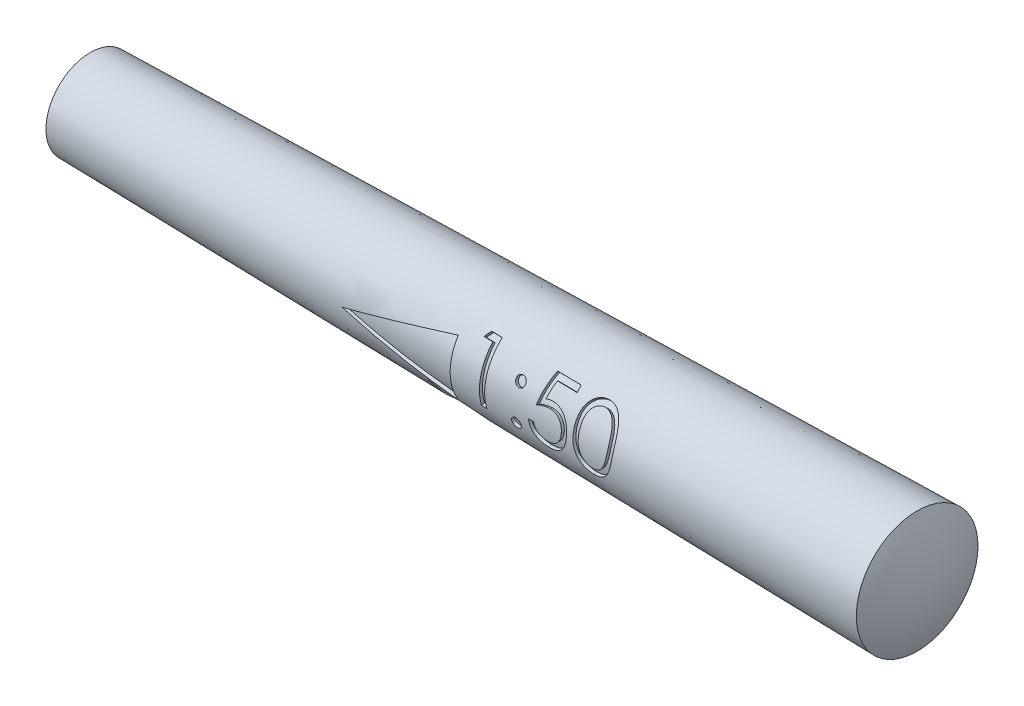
SolidWorks part; units mm, degrees
ref_plane "Front Plane" through (0, 0, 0) normal (0, 0, 1) x (1, 0, 0)
ref_plane "Top Plane" through (0, 0, 0) normal (0, 1, 0) x (1, 0, 0)
ref_plane "Right Plane" through (0, 0, 0) normal (1, 0, 0) x (0, 0, -1)
sketch "Sketch1" plane through (0, 0, 0) normal (1, 0, 0) x (0, 0, -1)
  circle A0 centre (0, 0) radius 0.75
  dimension "D1" = 1.5
extrude "Extrude1" add sketch "Sketch1" along normal mid plane 14
draft "Draft1" type of draft neutral plane draft angle 1.146 faces to draft 1 parameters "D1"=1.146
sketch "Sketch2" plane through (0, 0, 0) normal (0, 0, 1) x (1, 0, 0)
  line L0 (-7, 0) -> (-7, 0.75)
  line L1 (-7, 0.75) -> (-7, -0.75) construction
  line L2 (-7, 0) -> (-7.23, 0)
  line L3 (-7.23, 0) -> (-7.23, -0.89) construction
  line L4 (7, 0) -> (7, 1.03)
  line L5 (7, -1.03) -> (7, 1.03) construction
  line L6 (7, 0) -> (7.23, 0)
  line L7 (7.23, 0) -> (7.23, -0.89) construction
  line L8 (-7, -0.75) -> (7, -1.03) construction
  arc A0 (-7.23, 0) -> (-7, 0.75) centre (-5.8922, 0) cw
  arc A1 (7.23, 0) -> (7, 1.03) centre (4.8087, 0) ccw
  point P14 (0, -0.89)
revolve "Revolve1" add sketch "Sketch2" angle 360 about L2
sketch "Sketch5" plane through (0, 0, 0) normal (0, 0, 1) x (1, 0, 0)
  line L0 (0, 0.89) -> (0, -0.89) construction
  line L1 (7, 1.03) -> (-7, 0.75) construction
  line L2 (-7, -0.75) -> (7, -1.03) construction
ref_plane "Plane2" through (0, 0, 0) normal (-0.02, 0, 0.9998) x (0.9998, 0, 0.02)
sketch "Sketch6" plane through (0, 0, 0) normal (-0.02, 0, 0.9998) x (0.9998, 0, 0.02)
  line L0 (0, 0) -> (0, 0.5)
  line L1 (0, 0.89) -> (0, -0.89) construction
  line L2 (0, 0.5) -> (-1.866, 0)
  line L3 (-1.866, 0) -> (0, -0.5)
  line L4 (0, -0.5) -> (0, 0)
  line L5 (0, -0.25) -> (3, -0.25) construction
  text T0 "1:50" font "Century Gothic" height 1
  dimension "D1" = 1
  dimension "D2" = 30
  dimension "D3" = 3
wrap "Wrap2" sketch "Sketch6" wrap type deboss source sketch "Sketch6" thickness 0.05 parameters "D1"=0.05
equation "\"D2@Sketch2\" = \"D1@Sketch2\""
